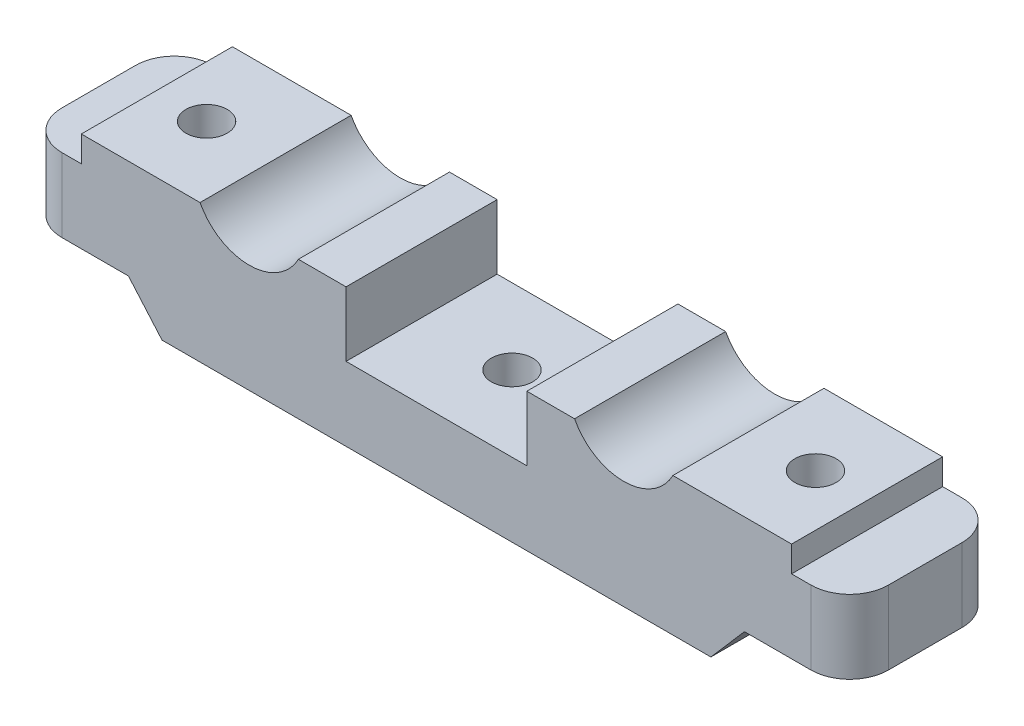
SolidWorks part; units mm, degrees
ref_plane "Plan1" through (0, 0, 0) normal (0, 0, 1) x (1, 0, 0)
ref_plane "Plan2" through (0, 0, 0) normal (0, 1, 0) x (1, 0, 0)
ref_plane "Plan3" through (0, 0, 0) normal (1, 0, 0) x (0, 0, -1)
sketch "Esquisse1" plane through (0, 0, 0) normal (0, 0, 1) x (1, 0, 0)
  line L0 (-21.25, 0) -> (21.25, 0)
  line L1 (21.25, 0) -> (23.85, 3)
  line L2 (23.85, 3) -> (32, 3)
  line L3 (32, 3) -> (32, 8.7)
  line L4 (32, 8.7) -> (27.5, 8.7)
  line L5 (27.5, 8.7) -> (27.5, 10.7)
  line L6 (27.5, 10.7) -> (18.3066, 10.7)
  line L7 (7, 10.7) -> (7, 5.7)
  line L8 (7, 5.7) -> (-7, 5.7)
  line L9 (-7, 5.7) -> (-7, 10.7)
  line L10 (-7, 10.7) -> (-10.6934, 10.7)
  line L11 (-27.5, 10.7) -> (-27.5, 8.7)
  line L12 (-27.5, 8.7) -> (-32, 8.7)
  line L13 (-32, 8.7) -> (-32, 3)
  line L14 (-32, 3) -> (-23.85, 3)
  line L15 (-23.85, 3) -> (-21.25, 0)
  line L16 (-18.3066, 10.7) -> (-27.5, 10.7)
  line L17 (10.6934, 10.7) -> (7, 10.7)
  arc A0 (-18.3066, 10.7) -> (-10.6934, 10.7) centre (-14.5, 12.7) ccw
  arc A1 (10.6934, 10.7) -> (18.3066, 10.7) centre (14.5, 12.7) ccw
  dimension "D1" = 14
  dimension "D2" = 7
  dimension "D3" = 5.7
  dimension "D4" = 42.5
  dimension "D5" = 47.7
  dimension "D6" = 3
  dimension "D7" = 64
  dimension "D8" = 32
  dimension "D9" = 10.7
  dimension "D10" = 5
  dimension "D11" = 55
  dimension "D12" = 29
  dimension "D13" = 14.5
  dimension "D14" = 2
extrude "Base-Extrusion" add sketch "Esquisse1" along normal blind 11.7
sketch "Esquisse2" plane through (0, 3, 0) normal (0, -1, 0) x (1, 0, 0)
  line L0 (23.85, 0) -> (32, 0) construction
  circle A0 centre (23.5, 5.85) radius 1.6
  circle A1 centre (-23.5, 6) radius 1.6
  circle A2 centre (0, 5.85) radius 1.6
  dimension "D4" = 3.2
  dimension "D1" = 5.85
  dimension "D2" = 47
  dimension "D3" = 23.5
extrude "Enlèv. mat.-Extru.1" cut sketch "Esquisse2" against normal mid plane 20
sketch "Esquisse3" plane through (0, 0, 0) normal (0, -1, 0) x (1, 0, 0)
  circle A0 centre (-23.5, 6) radius 3.7
  dimension "D1" = 7.4
extrude "Enlèv. mat.-Extru.2" cut sketch "Esquisse3" against normal blind 6
fillet "Congé1" radius 3
